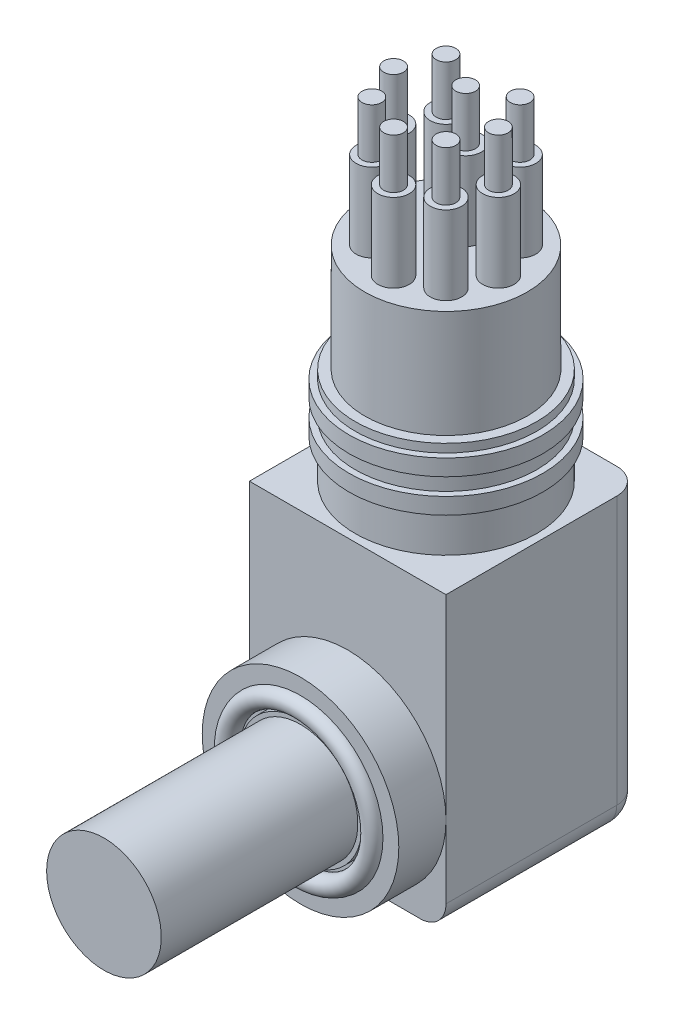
SolidWorks part; units mm, degrees
ref_plane "Front" through (0, 0, 0) normal (0, 0, 1) x (1, 0, 0)
ref_plane "Top" through (0, 0, 0) normal (0, 1, 0) x (1, 0, 0)
ref_plane "Right" through (0, 0, 0) normal (1, 0, 0) x (0, 0, -1)
sketch "Sketch1" plane through (0, 0, 0) normal (0, 1, 0) x (1, 0, 0)
  line L0 (9.525, -9.525) -> (-9.525, 9.525) construction
  line L1 (0, 10.9985) -> (-9.525, 5.4993) construction
  line L2 (-9.525, 5.4993) -> (-9.525, -5.4993) construction
  line L3 (-9.525, -5.4993) -> (0, -10.9985) construction
  line L4 (0, -10.9985) -> (9.525, -5.4993) construction
  line L5 (9.525, -5.4993) -> (9.525, 5.4993) construction
  line L6 (9.525, 5.4993) -> (0, 10.9985) construction
  line L7 (-9.525, 9.525) -> (9.525, 9.525)
  line L8 (-9.525, 9.525) -> (-9.525, -9.525)
  line L9 (-9.525, -9.525) -> (9.525, -9.525)
  line L10 (9.525, 9.525) -> (9.525, -9.525)
  circle A0 centre (0, 0) radius 9.525 construction
  dimension "D1" = 19.05
  dimension "D2" = 19.05
  dimension "D3" = 19.05
extrude "Extrude1" add sketch "Sketch1" along normal blind 28.448
sketch "Sketch2" plane through (0, 0, 0) normal (0, 0, 1) x (1, 0, 0)
  line L0 (0, 0) -> (0, -1.8388) construction
  line L1 (8.8011, 28.448) -> (8.8011, 32.2326)
  line L3 (8.8011, 32.2326) -> (9.398, 32.2326)
  line L4 (9.398, 32.2326) -> (9.398, 33.8074)
  line L5 (9.398, 33.8074) -> (8.8011, 33.8074)
  line L6 (8.8011, 33.8074) -> (8.8011, 35.4584)
  line L7 (8.8011, 35.4584) -> (9.398, 35.4584)
  line L8 (9.398, 35.4584) -> (9.398, 37.0332)
  line L9 (9.398, 37.0332) -> (8.8011, 37.0332)
  line L10 (8.8011, 37.0332) -> (8.8011, 37.846)
  line L11 (8.8011, 37.846) -> (0, 37.846)
  line L12 (0, 37.846) -> (0, 28.448)
  line L13 (-9.398, 32.2326) -> (-9.398, 33.8074) construction
  line L14 (-8.8011, 28.448) -> (-8.8011, 32.2326) construction
  line L15 (8.8011, 28.448) -> (0, 28.448)
  line L16 (9.525, 28.448) -> (-9.525, 28.448) construction
  dimension "D1" = 17.6022
  dimension "D2" = 18.796
  dimension "D3" = 1.5748
  dimension "D4" = 1.651
  dimension "D5" = 0.8128
  dimension "D6" = 9.398
revolve "Revolve1" add sketch "Sketch2" angle 360 about L0
sketch "Sketch3" plane through (0, 37.846, 0) normal (0, 1, 0) x (-1, 0, 0)
  circle A0 centre (0, 0) radius 7.874
  dimension "D1" = 15.748
extrude "Extrude2" add sketch "Sketch3" along normal blind 10.414
sketch "Sketch4" plane through (0, 48.26, 0) normal (0, 1, 0) x (-1, 0, 0)
  circle A0 centre (0, 5.08) radius 1.524
  circle A1 centre (0, 0) radius 5.08 construction
  dimension "D1" = 3.048
  dimension "D2" = 10.16
extrude "Extrude9" add sketch "Sketch4" along normal blind 7.62
sketch "Sketch12" plane through (0, 55.88, 0) normal (0, 1, 0) x (1, 0, 0)
  circle A0 centre (0, -5.08) radius 0.9525
  dimension "D1" = 1.905
extrude "Extrude10" add sketch "Sketch12" along normal blind 4.826
pattern_circular "CirPattern1" count 8 over 360 about axis through (0, 0, 0) along (0, 1, 0) of "Extrude9", "Extrude10"
sketch "1" plane through (0.0995, 48.26, 4.4802) normal (0, 1, 0) x (-1, 0, 0)
  circle A0 centre (0.0995, -6.3852) radius 1.524
  dimension "D1" = 3.048
  dimension "D2" = 1.905
extrude "Extrude11" add sketch "1" along normal blind 7.62
sketch "Sketch13" plane through (0, 55.88, 0) normal (0, 1, 0) x (1, 0, 0)
  circle A0 centre (0, 1.905) radius 0.9525
  dimension "D1" = 1.905
extrude "Extrude12" add sketch "Sketch13" along normal up to surface (4.826 mm away)
sketch "Sketch10" plane through (0, 0, 9.525) normal (0, 0, 1) x (1, 0, 0)
  line L0 (-9.525, 0) -> (9.525, 0) construction
  circle A0 centre (0, 9.525) radius 9.525
  dimension "D1" = 19.05
extrude "Extrude8" add sketch "Sketch10" along normal blind 4.572
sketch "Sketch11" plane through (0, 0, 14.097) normal (0, 0, 1) x (1, 0, 0)
  circle A0 centre (0, 9.525) radius 7.9885
  circle A1 centre (0, 9.525) radius 5.9565
  circle A2 centre (0, 9.525) radius 9.525 construction
  dimension "D1" = 15.977
  dimension "D2" = 11.913
extrude "Cut-Extrude1" cut sketch "Sketch11" against normal blind 1.27
sketch "Sketch8" plane through (0, 12.8, 14.097) normal (0, 0, -1) x (1, 0, 0)
  circle A0 centre (0, 3.275) radius 5.5562
  circle A1 centre (0, 3.275) radius 9.525 construction
  dimension "D1" = 11.1125
extrude "Extrude7" add sketch "Sketch8" against normal blind 19.05
sketch "Sketch9" plane through (0, -0.126, 0.126) normal (1, 0, 0) x (0, 1, 0)
  line L0 (9.651, 13.1375) -> (9.651, 9.5261) construction
  line L1 (19.176, 13.971) -> (0.126, 13.971) construction
  line L2 (9.651, 13.971) -> (9.651, 9.399) construction
  circle A0 centre (16.751, 13.971) radius 0.89
  circle A1 centre (2.551, 13.971) radius 0.89 construction
  dimension "D1" = 1.78
  dimension "D2" = 12.42
revolve "o-ring 12.42x1.78" add sketch "Sketch9" angle 360 about L0
fillet "Fillet1" radius 2.5 5 edges at (9.525, 0, 0) (0, 0, -9.525) (-9.525, 0, 0) (-9.525, 14.224, -9.525) (9.525, 14.224, -9.525)
